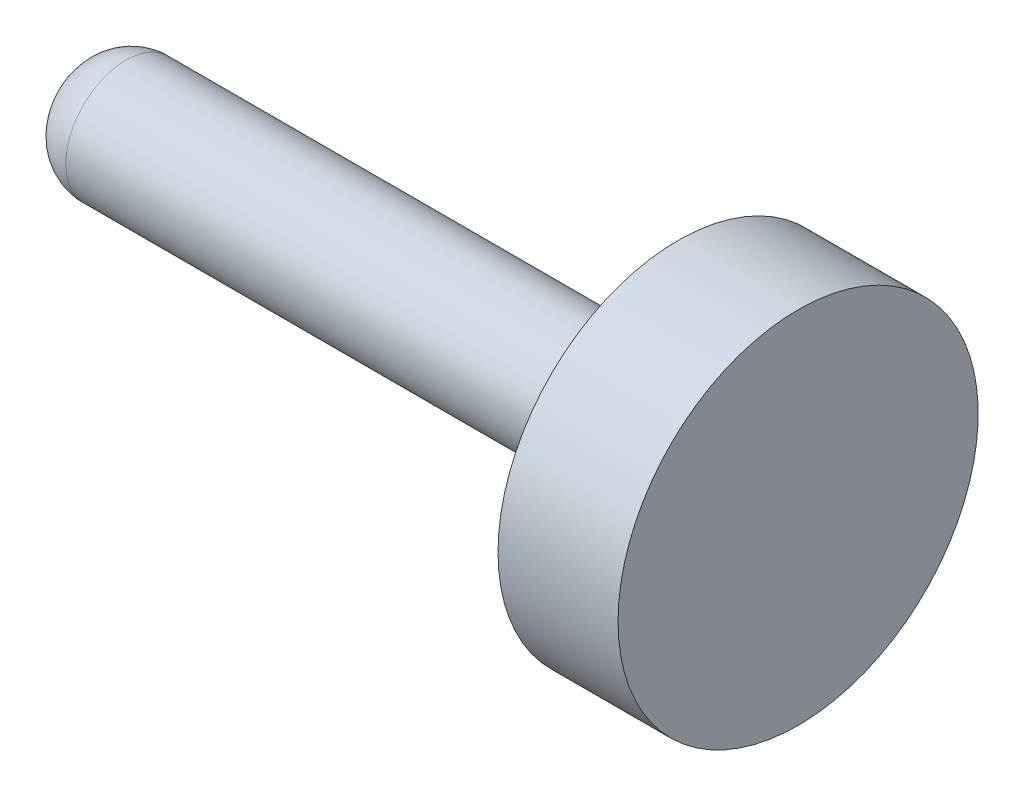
SolidWorks part; units mm, degrees
ref_plane "Plan de face" through (0, 0, 0) normal (0, 0, 1) x (1, 0, 0)
ref_plane "Plan de dessus" through (0, 0, 0) normal (0, 1, 0) x (1, 0, 0)
ref_plane "Plan de droite" through (0, 0, 0) normal (1, 0, 0) x (0, 0, -1)
sketch "Esquisse1" plane through (0, 0, 0) normal (0, 0, 1) x (1, 0, 0)
  line L0 (0, 0) -> (0, 3)
  line L1 (0, 3) -> (-2, 3)
  line L2 (-2, 3) -> (-2, 1)
  line L3 (-2, 1) -> (-12, 1)
  line L4 (-12, 1) -> (-12, 0)
  line L5 (-12, 0) -> (0, 0)
  dimension "D1" = 3
  dimension "D2" = 1
  dimension "D3" = 12
  dimension "D4" = 2
revolve "Révolution1" add sketch "Esquisse1" angle 360 about L5
fillet "Congé1" radius 0.8 1 edges at (-12, 0, 1)
